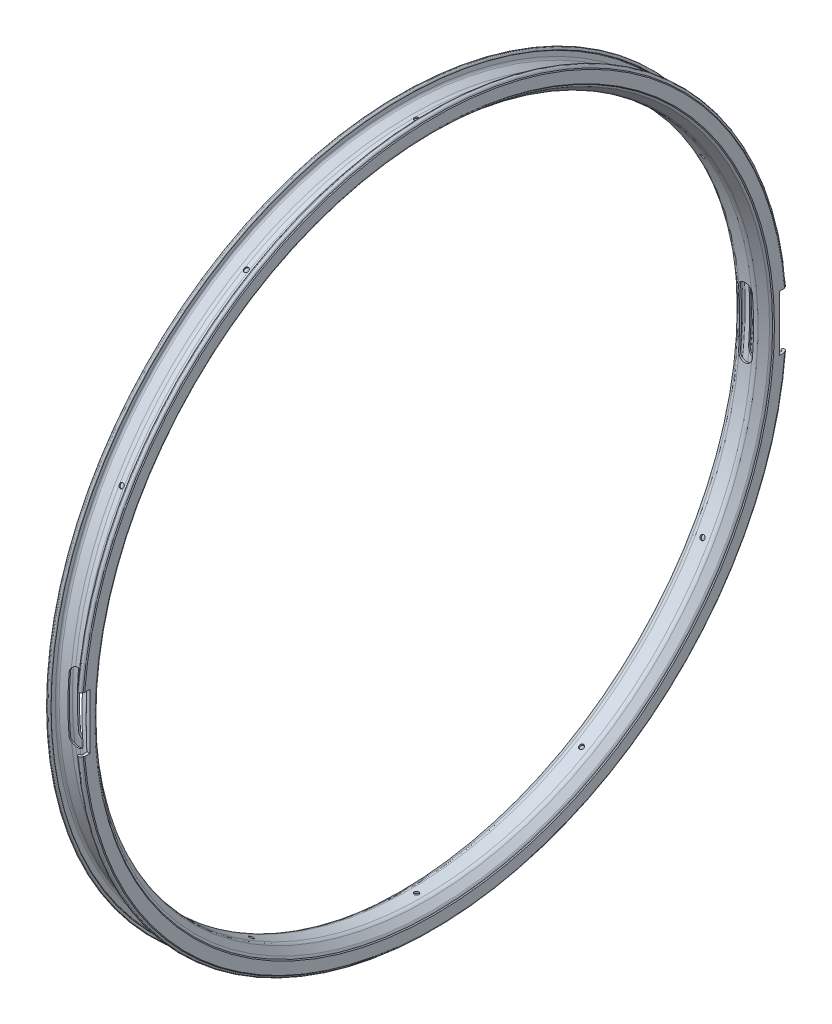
SolidWorks part; units mm, degrees
ref_plane "FRONT" through (0, 0, 0) normal (0, 0, 1) x (1, 0, 0)
ref_plane "TOP" through (0, 0, 0) normal (0, 1, 0) x (1, 0, 0)
ref_plane "SIDE" through (0, 0, 0) normal (1, 0, 0) x (0, 0, -1)
sketch "Sketch1" plane through (0, 0, 0) normal (0, 0, 1) x (1, 0, 0)
  line L0 (-9.9695, 242.6716) -> (-10.2997, 242.6716)
  line L1 (9.9695, 242.6716) -> (10.2997, 242.6716)
  line L2 (-76.2, 0) -> (152.4, 0) construction
  line L3 (-9.9695, 240.8936) -> (-10.092, 240.8936)
  line L4 (-10.5975, 240.3354) -> (-10.2988, 237.3294)
  line L5 (-9.1587, 235.8347) -> (-3.8368, 233.7919)
  line L6 (-4.0167, 232.9238) -> (-9.568, 234.9314)
  line L7 (-10.6232, 234.191) -> (-10.6232, 232.733)
  line L8 (-12.3825, 232.9434) -> (-11.7717, 232.3326)
  line L9 (-10.0816, 231.5445) -> (-7.0515, 228.9105)
  line L10 (-11.074, 230.868) -> (-6.8811, 227.2232)
  line L11 (-1.5202, 232.4862) -> (1.5202, 232.4862)
  line L12 (10.5975, 240.3354) -> (10.2988, 237.3294)
  line L13 (11.8491, 241.1222) -> (12.3825, 240.5888)
  line L14 (12.3825, 232.9434) -> (11.7717, 232.3326)
  line L15 (10.092, 240.8936) -> (9.9695, 240.8936)
  line L16 (-11.8491, 241.1222) -> (-12.3825, 240.5888)
  line L17 (10.8336, 234.5939) -> (10.8398, 232.7383)
  line L19 (9.1587, 235.8347) -> (3.8368, 233.7919)
  line L20 (-1.5202, 233.3625) -> (1.5202, 233.3625)
  line L21 (4.2846, 233.0266) -> (9.7532, 235.2497)
  line L22 (7.0515, 228.9105) -> (10.2569, 231.5099)
  line L23 (6.8811, 227.2232) -> (11.074, 230.868)
  line L24 (-3.562, 227.5224) -> (3.562, 227.5224)
  line L25 (-4.3815, 226.2886) -> (4.3815, 226.2886)
  line L26 (0, 226.2886) -> (0, 236.3396) construction
  line L46 (-12.3825, 240.5888) -> (-12.3825, 232.9434)
  line L53 (12.3825, 240.5888) -> (12.3825, 232.9434)
  arc A11 (11.8491, 241.1222) -> (10.2997, 242.6716) centre (10.2997, 241.1222) ccw
  arc A12 (11.074, 230.868) -> (11.7717, 232.3326) centre (9.7409, 232.4016) ccw
  arc A13 (9.9695, 242.6716) -> (9.9695, 240.8936) centre (9.9695, 241.7826) ccw
  arc A14 (10.5975, 240.3354) -> (10.092, 240.8936) centre (10.092, 240.3856) ccw
  arc A15 (9.1587, 235.8347) -> (10.2988, 237.3294) centre (8.5169, 237.5065) ccw
  arc A18 (-10.2997, 242.6716) -> (-11.8491, 241.1222) centre (-10.2997, 241.1222) ccw
  arc A19 (-9.9695, 240.8936) -> (-9.9695, 242.6716) centre (-9.9695, 241.7826) ccw
  arc A21 (-10.092, 240.8936) -> (-10.5975, 240.3354) centre (-10.092, 240.3856) ccw
  arc A23 (-10.2988, 237.3294) -> (-9.1587, 235.8347) centre (-8.5169, 237.5065) ccw
  arc A24 (1.5202, 232.4862) -> (4.2846, 233.0266) centre (1.5202, 239.8268) ccw
  arc A25 (1.5202, 233.3625) -> (3.8368, 233.7919) centre (1.5202, 239.8268) ccw
  arc A26 (10.2569, 231.5099) -> (10.8398, 232.7383) centre (9.265, 232.733) ccw
  arc A27 (-3.8368, 233.7919) -> (-1.5202, 233.3625) centre (-1.5202, 239.8268) ccw
  arc A28 (-4.0167, 232.9238) -> (-1.5202, 232.4862) centre (-1.5202, 239.8268) ccw
  arc A29 (-10.6232, 232.733) -> (-10.0816, 231.5445) centre (-9.0484, 232.733) ccw
  arc A30 (-11.7717, 232.3326) -> (-11.074, 230.868) centre (-9.7409, 232.4016) ccw
  arc A33 (-6.8811, 227.2232) -> (-4.3815, 226.2886) centre (-4.3815, 230.0986) ccw
  arc A34 (-7.0515, 228.9105) -> (-3.562, 227.5224) centre (-3.562, 232.6024) ccw
  arc A39 (3.562, 227.5224) -> (7.0515, 228.9105) centre (3.562, 232.6024) ccw
  arc A41 (4.3815, 226.2886) -> (6.8811, 227.2232) centre (4.3815, 230.0986) ccw
  arc A42 (10.8336, 234.5939) -> (9.7532, 235.2497) centre (10.0497, 234.5202) ccw
  arc A43 (-9.568, 234.9314) -> (-10.6232, 234.191) centre (-9.8358, 234.191) ccw
  point P6 (0, 233.3625)
  point P7 (0, 227.5224)
  point P8 (0, 226.2886)
  point P11 (0, 232.4862)
  dimension "D3" = 8.763
  dimension "D2" = 233.3625
  dimension "D17" = 5.08
  dimension "D18" = 2.032
  dimension "D19" = 0.7874
  dimension "D20" = 1.5748
  dimension "D21" = 20.1839
  dimension "D9" = 7.0739
  dimension "D14" = 0.889
  dimension "D16" = 4.144
  dimension "D22" = 1.7907
  dimension "D27" = 6.4643
  dimension "D1" = 24.765
  dimension "D4" = 3.0404
  dimension "D5" = 10.8623
  dimension "D6" = 17.0339
  dimension "D7" = 3.8656
  dimension "D8" = 19.939
  dimension "D10" = 8.4201
  dimension "D11" = 19.4818
  dimension "D12" = 8.4201
  dimension "D13" = 18.3134
  dimension "D15" = 19.8882
  dimension "D23" = 20.5994
  dimension "D24" = 3.81
  dimension "D25" = 2.0828
  dimension "D26" = 6.4444
revolve "Base-Revolve" add sketch "Sketch1" angle 360 about L2
sketch "Sketch2" plane through (0, 0, 0) normal (0, 0, 1) x (1, 0, 0)
  line L0 (12.3825, -240.5888) -> (12.3825, 240.5888) construction
  line L1 (4.7511, -19.05) -> (4.7511, 19.05)
  line L11 (-4.7765, -19.05) -> (-4.7765, 19.05)
  arc A0 (-4.7765, 19.05) -> (4.7511, 19.05) centre (-0.0127, 19.05) cw
  arc A1 (4.7511, -19.05) -> (-4.7765, -19.05) centre (-0.0127, -19.05) cw
  point P9 (-4.7765, 0)
  dimension "D2" = 19.05
  dimension "D3" = 38.1
  dimension "D4" = 12.3952
  dimension "D1" = 9.5275
extrude "Cut-Extrude1" cut sketch "Sketch2" against normal through all and the other way through all
sketch "Sketch3" plane through (0, 0, 0) normal (0, 1, 0) x (1, 0, 0)
  line L0 (-76.2, 0) -> (152.4, 0) construction
  circle A1 centre (0, 0) radius 1.5875
  dimension "D1" = 3.175
extrude "Cut-Extrude2" cut sketch "Sketch3" against normal through all
pattern_circular "CirPattern1" count 12 over 360 about axis through (-76.2, 0, 0) along (1, 0, 0)
sketch "Sketch4" plane through (0, 0, 0) normal (1, 0, 0) x (0, 0, -1)
  line L0 (236.22, 19.05) -> (261.62, 19.05)
  line L1 (261.62, 19.05) -> (261.62, -19.05)
  line L2 (-258.7764, 19.05) -> (-236.22, 19.05)
  line L3 (236.22, -19.05) -> (261.62, -19.05)
  line L4 (236.22, -19.05) -> (236.22, 19.05)
  line L5 (-236.22, 19.05) -> (-236.22, -19.05)
  line L6 (-258.7764, -19.05) -> (-236.22, -19.05)
  line L7 (-258.7764, -19.05) -> (-258.7764, 19.05)
  dimension "D1" = 236.22
  dimension "D4" = 25.4
  dimension "D5" = 236.22
  dimension "D6" = 25.4
  dimension "D7" = 19.05
  dimension "D8" = 19.05
extrude "Cut-Extrude3" cut sketch "Sketch4" along normal through all
